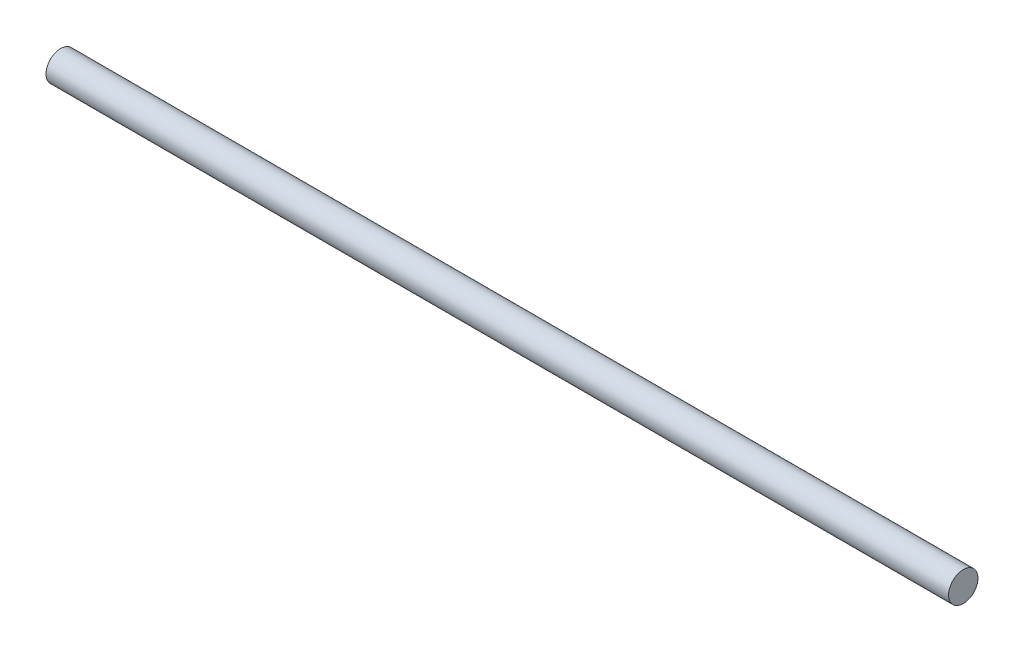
SolidWorks part; units mm, degrees
ref_plane "Front Plane" through (0, 0, 0) normal (0, 0, 1) x (1, 0, 0)
ref_plane "Top Plane" through (0, 0, 0) normal (0, 1, 0) x (1, 0, 0)
ref_plane "Right Plane" through (0, 0, 0) normal (1, 0, 0) x (0, 0, -1)
sketch "Sketch1" plane through (0, 0, 0) normal (1, 0, 0) x (0, 0, -1)
  circle A0 centre (0, 0) radius 2.3813
  dimension "D1" = 4.7625
extrude "Boss-Extrude1" add sketch "Sketch1" along normal mid plane 146.05
